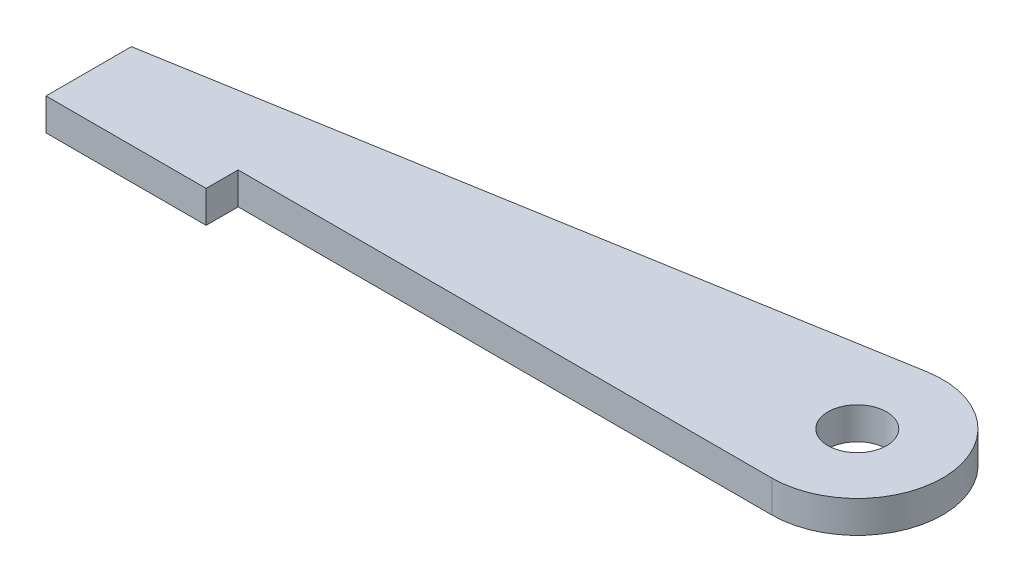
SolidWorks part; units mm, degrees
ref_plane "Front" through (0, 0, 0) normal (0, 0, 1) x (1, 0, 0)
ref_plane "Top" through (0, 0, 0) normal (0, 1, 0) x (1, 0, 0)
ref_plane "Right" through (0, 0, 0) normal (1, 0, 0) x (0, 0, -1)
sketch "Sketch1" plane through (0, 0, 0) normal (0, 1, 0) x (1, 0, 0)
  line L0 (0, 0) -> (0, -8)
  line L1 (0, -8) -> (15, -8)
  line L2 (15, -8) -> (15, -5)
  line L3 (15, -5) -> (65, -5)
  line L4 (0, 0) -> (63.6514, 10.8855)
  arc A0 (65, -5) -> (63.6514, 10.8855) centre (65, 3) ccw
  circle A1 centre (65, 3) radius 2.75
extrude "Extrude1" add sketch "Sketch1" along normal blind 3
